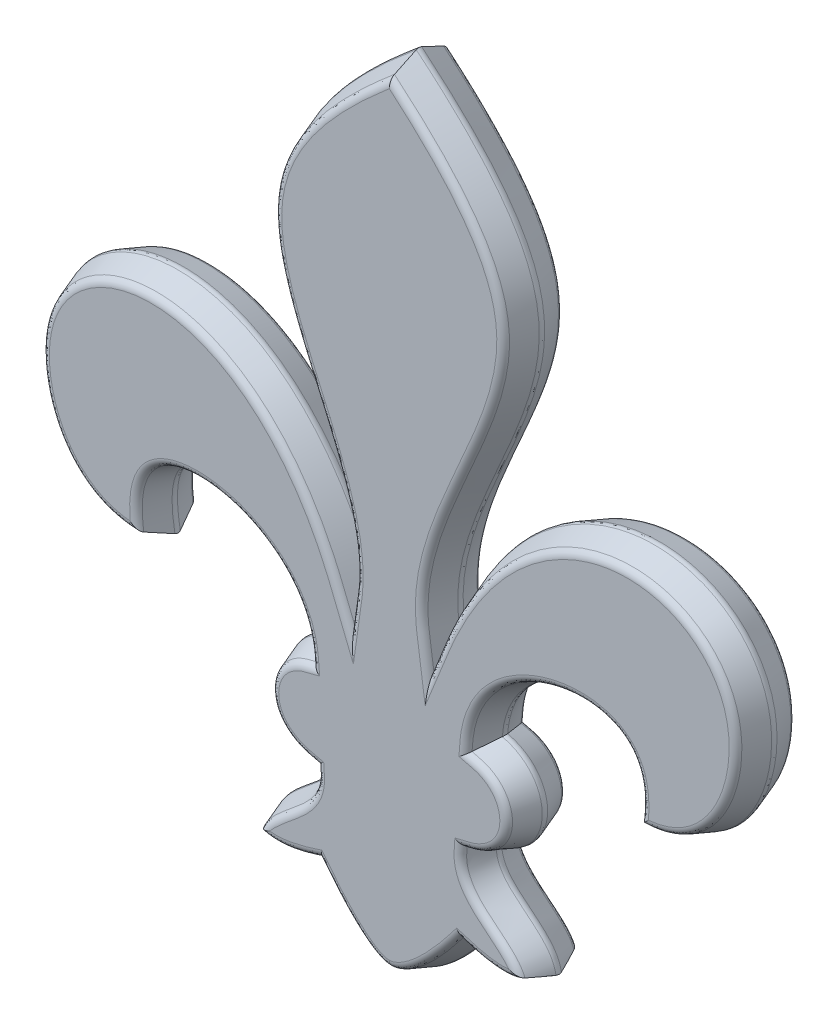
SolidWorks part; units mm, degrees
ref_plane "Front Plane" through (0, 0, 0) normal (0, 0, 1) x (1, 0, 0)
ref_plane "Top Plane" through (0, 0, 0) normal (0, 1, 0) x (1, 0, 0)
ref_plane "Right Plane" through (0, 0, 0) normal (1, 0, 0) x (0, 0, -1)
sketch "Picture" plane through (0, 0, 0) normal (0, 0, 1) x (1, 0, 0)
  line L0 (0.0171, 107.1456) -> (0.0171, -92.8544) construction
  dimension "D1" = 200
sketch "Sketch2" plane through (0, 0, 0) normal (0, 0, 1) x (1, 0, 0)
  line L0 (0, 107) -> (0, -93) construction
  line L1 (4.5299, -93) -> (-4.5308, -93) construction
  spline S0 degree 3 poles (0, 107) (-21.1332, 89.4248) (-46.7086, 53.7894) (-7.7623, 10.1995) (-11.0052, -12.9118) knots 0 0 0 0 0.390159 1 1 1 1
  spline S1 degree 3 poles (-11.0052, -12.9118) (-34.4762, 44.9858) (-111.5748, 31.1667) (-81.4582, -31.3159) (-60.6144, -29.7575) knots 0 0 0 0 0.698087 1 1 1 1
  spline S2 degree 3 poles (-60.6144, -29.7575) (-62.4144, -20.2533) (-58.1375, -3.318) (-23.461, -13.3408) (-21.9633, -32.4072) knots 0 0 0 0 0.319347 1 1 1 1
  spline S3 degree 3 poles (-21.9633, -32.4072) (-35.2998, -35.6977) (-35.9524, -53.6714) (-20.4818, -57.212) knots 0 0 0 0 1 1 1 1
  spline S4 degree 3 poles (-20.4818, -57.212) (-19.9521, -65.9384) (-34.235, -69.0174) (-35.5153, -78.0761) knots 0 0 0 0 1 1 1 1
  spline S5 degree 2 poles (-35.5153, -78.0761) (-30.2321, -81.8361) (-18.5066, -78.1408) knots 0 0 0 1 1 1
  spline S6 degree 2 poles (-18.5066, -78.1408) (-6.9652, -93) (0, -93) knots 0 0 0 1 1 1
  spline S7 degree 2 poles (18.5066, -78.1408) (6.9652, -93) (0, -93) knots 0 0 0 1 1 1
  spline S8 degree 2 poles (35.5153, -78.0761) (30.2321, -81.8361) (18.5066, -78.1408) knots 0 0 0 1 1 1
  spline S9 degree 3 poles (20.4818, -57.212) (19.9521, -65.9384) (34.235, -69.0174) (35.5153, -78.0761) knots 0 0 0 0 1 1 1 1
  spline S10 degree 3 poles (21.9633, -32.4072) (35.2998, -35.6977) (35.9524, -53.6714) (20.4818, -57.212) knots 0 0 0 0 1 1 1 1
  spline S11 degree 3 poles (60.6144, -29.7575) (62.4144, -20.2533) (58.1375, -3.318) (23.461, -13.3408) (21.9633, -32.4072) knots 0 0 0 0 0.319347 1 1 1 1
  spline S12 degree 3 poles (11.0052, -12.9118) (34.4762, 44.9858) (111.5748, 31.1667) (81.4582, -31.3159) (60.6144, -29.7575) knots 0 0 0 0 0.698087 1 1 1 1
  spline S13 degree 3 poles (0, 107) (21.1332, 89.4248) (46.7086, 53.7894) (7.7623, 10.1995) (11.0052, -12.9118) knots 0 0 0 0 0.390159 1 1 1 1
  dimension "D1" = 200
  dimension "D2" = 107
extrude "Boss-Extrude1" add sketch "Sketch2" along normal mid plane 15 draft 20
fillet "Fillet1" radius 2 68 edges at (-83.4784, 13.9923, -7.5) (83.3919, 18.7118, 0) (50.1601, -10.3277, 0) (-49.5575, -7.5536, -7.5) (32.0138, -43.9138, 0) (24.5946, -65.1921, 0) (25.1454, -79.7138, 0) (6.1883, -90.7004, 0) (-4.8041, -91.5467, 0) (-32.3196, -79.5307, 0) (-26.1083, -66.5187, 0) (-29.2812, -43.9348, -7.5) (-31.9755, -45.5958, 0) (-52.452, -10.6517, 0) (-87.2813, 12.694, 0) (-31.2701, 60.0823, 0) (28.3755, 44.1008, 0) (-20.4761, -64.8128, -7.5) (-28.8388, -77.2401, -7.5) (10.1931, -19.4881, -4.7203) (62.2281, -28.4707, -3.7563) (20.5119, -33.4549, -3.75) (19.1814, -56.1094, -3.75) (33.7485, -77.3134, -4.3307) (17.9433, -76.3361, -4.264) (-17.9321, -76.3002, -4.3488) (-33.7123, -77.2978, -4.4148) (-19.1814, -56.1094, -3.75) (-20.5119, -33.4549, -3.75) (-62.2281, -28.4707, -3.7563) (-10.1931, -19.4881, -4.7203) (0, 105.2209, -3.7513) (-7.1466, -86.5379, -7.5) (6.2039, -87.3128, -7.5) (24.5813, -76.8594, -7.5) (19.4844, -63.438, -7.5) (29.2843, -44.9812, -7.5) (28.3738, 56.6552, -7.5) (51.1506, -7.6827, -7.5) (10.1931, -19.4881, 4.7203) (0, 105.2209, 3.7513) (-10.1931, -19.4881, 4.7203) (-62.2281, -28.4707, 3.7563) (79.3267, 18.9927, -7.5) (-20.5119, -33.4549, 3.75) (-19.1814, -56.1094, 3.75) (-33.7123, -77.2978, 4.4148) (-17.9321, -76.3002, 4.3488) (17.9433, -76.3361, 4.264) (33.7485, -77.3134, 4.3307) (19.1814, -56.1094, 3.75) (20.5119, -33.4549, 3.75) (62.2281, -28.4707, 3.7563) (28.3738, 56.6552, 7.5) (-28.4031, 63.0014, 7.5) (-83.4784, 13.9923, 7.5) (-49.5575, -7.5536, 7.5) (-29.2812, -43.9348, 7.5) (-20.4761, -64.8128, 7.5) (-28.8388, -77.2401, 7.5) (-7.1466, -86.5379, 7.5) (6.2039, -87.3128, 7.5) (24.5813, -76.8594, 7.5) (19.4844, -63.438, 7.5) (29.2843, -44.9812, 7.5) (51.1506, -7.6827, 7.5) (79.3267, 18.9927, 7.5) (-28.4031, 63.0014, -7.5)
